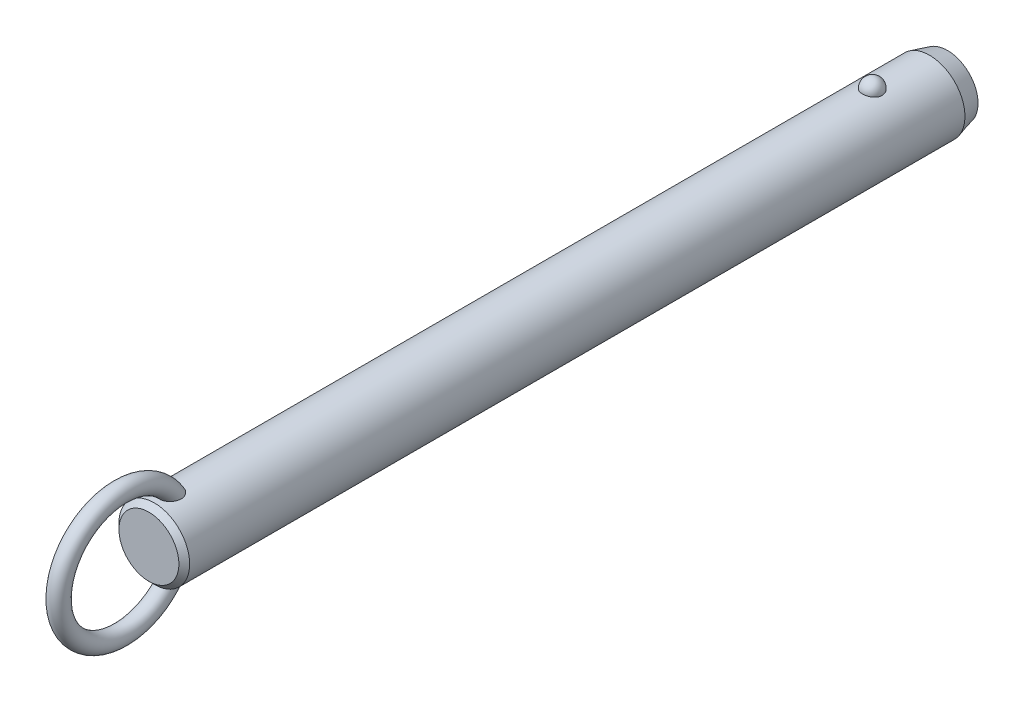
SolidWorks part; units mm, degrees
ref_plane "Front Plane" through (0, 0, 0) normal (0, 0, 1) x (1, 0, 0)
ref_plane "Top Plane" through (0, 0, 0) normal (0, 1, 0) x (1, 0, 0)
ref_plane "Right Plane" through (0, 0, 0) normal (1, 0, 0) x (0, 0, -1)
sketch "Sketch2" plane through (0, 0, 0) normal (0, 0, 1) x (1, 0, 0)
  circle A0 centre (0, 0) radius 7.9
  point P3 (0, 7.9)
  dimension "D1" = 15.8
extrude "Boss-Extrude1" add sketch "Sketch2" along normal blind 149.9
sketch "Sketch3" plane through (0, 0, 0) normal (0, 0, -1) x (-1, 0, 0)
  circle A0 centre (0, 0) radius 7.9
  dimension "D1" = 15.8
extrude "Boss-Extrude2" add sketch "Sketch3" along normal blind 19
chamfer "Chamfer1" distance 4 angle 15 1 edges at (-7.9, 0, -19)
sketch "Sketch12" plane through (0, 0, 0) normal (1, 0, 0) x (0, 0, -1)
  line L0 (-149.9, 7.9) -> (-149.9, -7.9) construction
  point P0 (-149.9, 0)
sketch "Sketch13" plane through (0, 0, 0) normal (1, 0, 0) x (0, 0, -1)
  circle A0 centre (-165.75, 0) radius 15.85
  point P2 (-149.9, 0)
  dimension "D1" = 31.7
sketch "Sketch14" plane through (0, 0, 0) normal (0, 1, 0) x (1, 0, 0)
  circle A0 centre (0, -151.9) radius 2
  point P2 (0, -149.9)
  dimension "D1" = 4
sweep "Sweep1" add profiles "Sketch14" path "Sketch13"
sketch "Sketch15" plane through (0, 0, 149.9) normal (0, 0, 1) x (1, 0, 0)
  circle A0 centre (0, 0) radius 7.9
  dimension "D1" = 15.8
extrude "Boss-Extrude3" add sketch "Sketch15" along normal blind 9.52
chamfer "Chamfer2" distance 1.2 angle 45 1 edges at (7.9, 0, 159.42)
sketch "Sketch18" plane through (0, 0, 0) normal (1, 0, 0) x (0, 0, -1)
  line L0 (15, 7.9) -> (-152.0091, 7.9) construction
  line L1 (2.2, 10.1) -> (2.2, 5.7)
  line L2 (-152.0091, -7.9) -> (15, -7.9) construction
  arc A0 (2.2, 10.1) -> (2.2, 5.7) centre (2.2, 7.9) ccw
  point P4 (0, 7.9)
  dimension "D1" = 18
revolve "Revolve1" add sketch "Sketch18" angle 360 about L1
